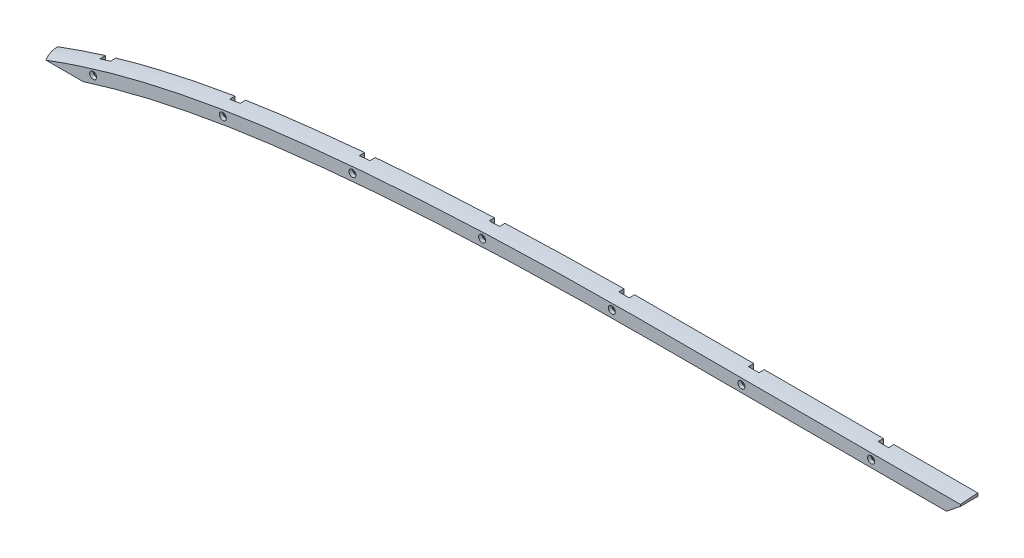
SolidWorks part; units mm, degrees
other "<Mirror 0 Tail Flange Base Part Extended>-<<0 Tail Flange Base Part Extended>-<#8-32 Tapped Hole1>>"
ref_plane "Front Plane" through (0, 0, 0) normal (0, 0, 1) x (1, 0, 0)
ref_plane "Top Plane" through (0, 0, 0) normal (0, 1, 0) x (1, 0, 0)
ref_plane "Right Plane" through (0, 0, 0) normal (1, 0, 0) x (0, 0, -1)
inserted part "Mirror 0 Tail Flange Base Part Extended"
hole_wizard "3/8 (0.375) Diameter Hole1" positions "Sketch4" profile "Sketch3" hole size "3/8" standard "ANSI Inch"
sketch "Sketch4" plane through (0, 0, 9.525) normal (0, 0, -1) x (-1, 0, 0)
  point P0 (-473.0856, 247.65)
  point P3 (-238.1356, 247.7714)
  point P6 (-3.1856, 247.6755)
  point P9 (231.7644, 242.004)
  point P12 (466.7144, 227.2223)
  point P15 (701.6644, 198.9768)
  point P18 (936.6144, 145.9432)
sketch "Sketch3" plane through (473.0856, 247.65, 9.525) normal (1, 0, 0) x (0, 1, 0)
  line L0 (0, 0) -> (0, 54.3155)
  line L1 (0, 54.3155) -> (4.7625, 54.3155)
  line L2 (4.7625, 54.3155) -> (4.7625, 0)
  line L5 (4.7625, 0) -> (0, 0)
  line L11 (0, -6.35) -> (0, 107.95) construction
  dimension "Thru Hole Dia." = 9.525
  dimension "Thru Hole Depth" = 54.3155
sketch "Sketch5" plane through (0, 0, 31.75) normal (0, 0, 1) x (1, 0, 0)
  circle A0 centre (473.0856, 247.65) radius 6.35
  circle A1 centre (238.1356, 247.7714) radius 6.35
  circle A2 centre (3.1856, 247.6755) radius 6.35
  circle A3 centre (-231.7644, 242.004) radius 6.35
  circle A4 centre (-466.7144, 227.2223) radius 6.35
  circle A5 centre (-701.6644, 198.9768) radius 6.35
  circle A6 centre (-936.6144, 145.9432) radius 6.35
  dimension "D1" = 12.7
extrude "Cut-Extrude3" cut sketch "Sketch5" against normal blind 6.35
sketch "Sketch7" plane through (0, 0, 0) normal (0, 0, -1) x (-1, 0, 0)
  line L0 (-635, 260.35) -> (-635, 255.27)
  line L1 (-635, 260.35) -> (-635, 234.95) construction
  line L2 (-635, 255.27) -> (-609.6, 234.9499)
  line L3 (-646.9096, 234.9499) -> (-646.9096, 229.9187)
  line L4 (-646.9096, 234.9499) -> (-646.9096, 260.35)
  line L5 (-646.9096, 260.35) -> (-635, 260.35)
  line L6 (-646.9096, 229.9187) -> (-609.6, 229.9187)
  line L7 (-609.6, 229.9187) -> (-609.6, 234.9499)
  spline S0 degree 3 poles (-634.9864, 234.95) (-632.7181, 234.9512) (-630.4459, 234.9511) (-625.8937, 234.9503) (-623.6125, 234.9498) (-616.7733, 234.9493) (-612.2158, 234.9497) (-598.5491, 234.9505) (-589.4361, 234.95) (-562.0973, 234.9501) (-543.8721, 234.9501) (-511.3012, 234.9501) (-496.9559, 234.9501) (-482.6106, 234.9501) knots 0.912903 0.912903 0.912903 0.912903 0.916809 0.916809 0.920716 0.920716 0.928528 0.928528 0.944153 0.944153 0.975403 0.975403 1 1 1 1 construction
  dimension "D1" = 5.08
  dimension "D2" = 25.4
extrude "Cut-Extrude9" cut sketch "Sketch7" against normal through all
